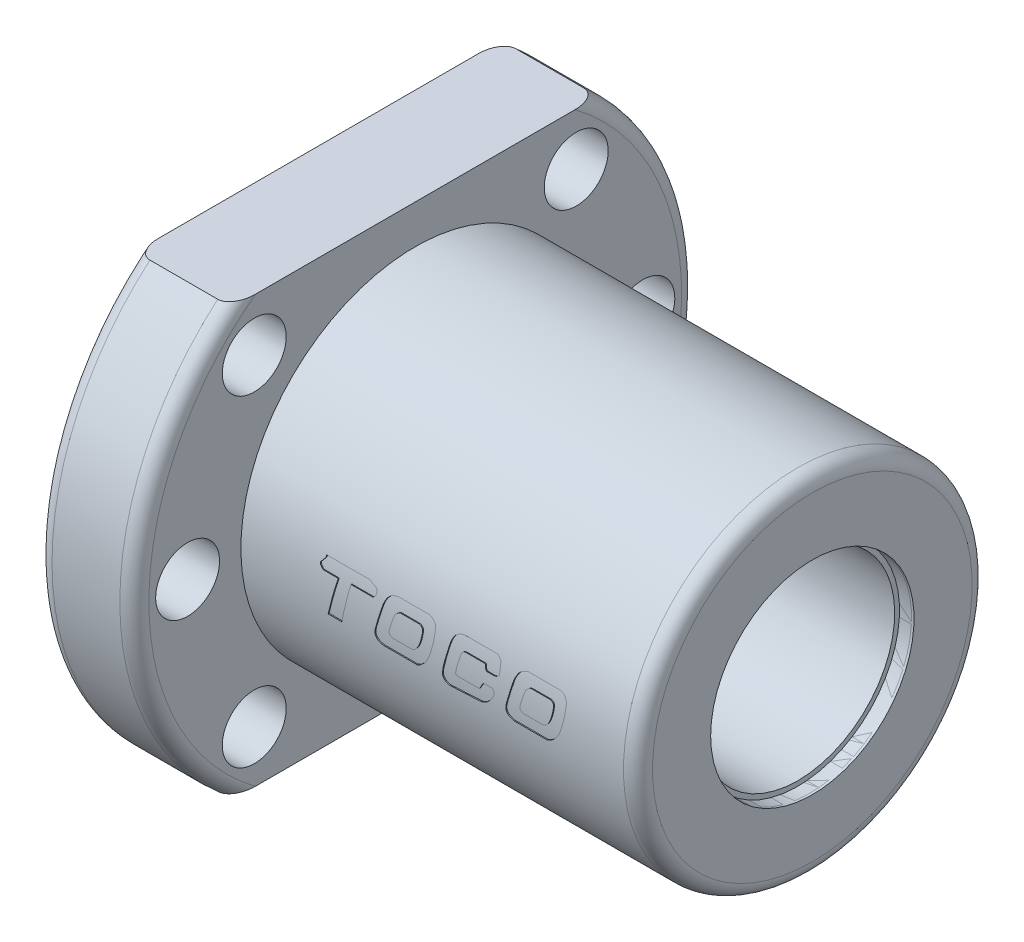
SolidWorks part; units mm, degrees
other "____1[2]"
other "____1[1]"
ref_plane "Front Plane" through (0, 0, 0) normal (0, 0, 1) x (1, 0, 0)
ref_plane "Top Plane" through (0, 0, 0) normal (0, 1, 0) x (1, 0, 0)
ref_plane "Right Plane" through (0, 0, 0) normal (1, 0, 0) x (0, 0, -1)
imported_body "Imported1"
imported_body "Imported2"
sketch "Sketch1" plane through (-82, 0, 0) normal (-1, 0, 0) x (0, 0, 1)
  circle A0 centre (0, 0) radius 10
extrude "Cut-Extrude1" cut sketch "Sketch1" against normal up to surface (82 mm away)
move or copy body "Body-Move/Copy1" bodies to move or copy 103 copy no rotation origin (-40.3719, 0, 0) rotation axis (0, 0, 1) rotation angle 180
